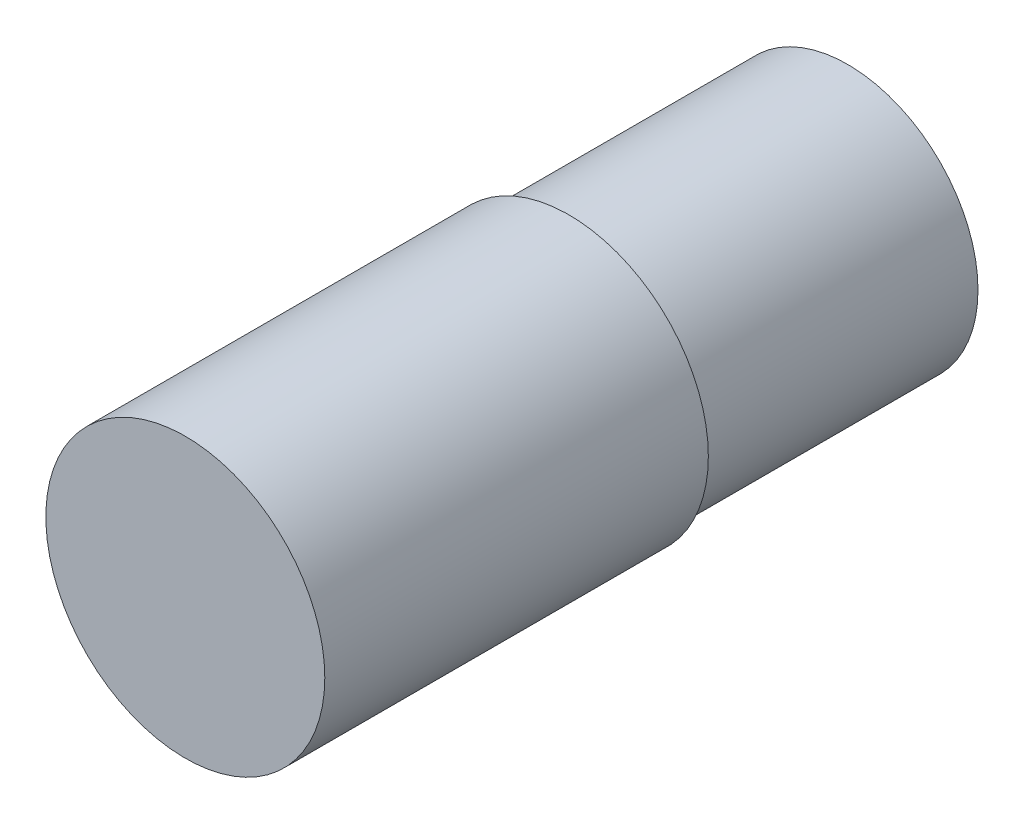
SolidWorks part; units mm, degrees
ref_plane "Face" through (0, 0, 0) normal (0, 0, 1) x (1, 0, 0)
ref_plane "Dessus" through (0, 0, 0) normal (0, 1, 0) x (1, 0, 0)
ref_plane "Droite" through (0, 0, 0) normal (1, 0, 0) x (0, 0, -1)
sketch "Esquisse1" plane through (0, 0, 0) normal (0, 0, 1) x (1, 0, 0)
  circle A0 centre (0, 0) radius 28
  dimension "D1" = 56
extrude "Extrusion1" add sketch "Esquisse1" along normal blind 60
sketch "Esquisse2" plane through (0, 0, 60) normal (0, 0, 1) x (1, 0, 0)
  circle A0 centre (0, 0) radius 30
  dimension "D1" = 60
extrude "Extrusion2" add sketch "Esquisse2" along normal blind 82.5
